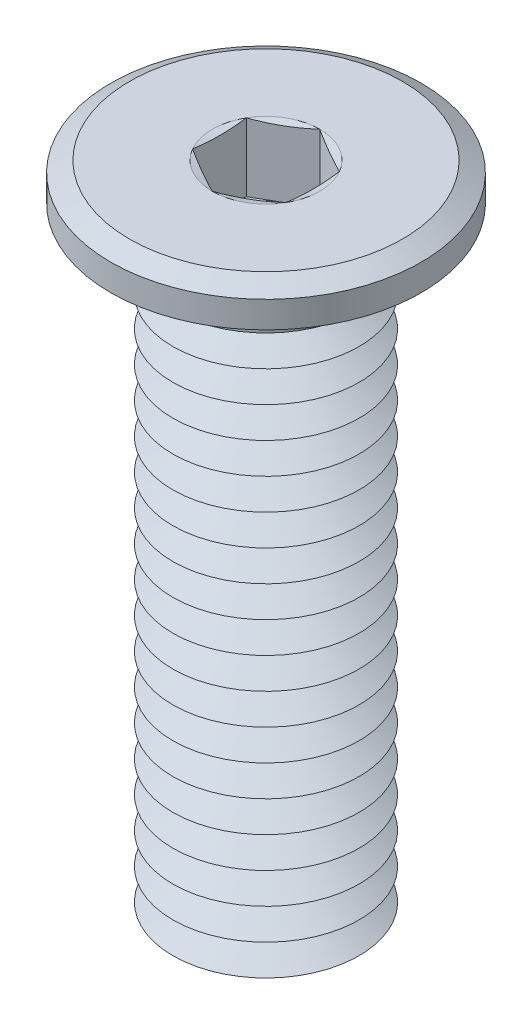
SolidWorks part; units mm, degrees
ref_plane "Front Plane" through (0, 0, 0) normal (0, 0, 1) x (1, 0, 0)
ref_plane "Top Plane" through (0, 0, 0) normal (0, 1, 0) x (1, 0, 0)
ref_plane "Right Plane" through (0, 0, 0) normal (1, 0, 0) x (0, 0, -1)
sketch "Sketch1" plane through (0, 0, 0) normal (0, 1, 0) x (1, 0, 0)
  circle A0 centre (0, 0) radius 5
  dimension "D1" = 10
extrude "Boss-Extrude1" add sketch "Sketch1" against normal blind 1.2
sketch "Sketch2" plane through (0, -1.2, 0) normal (0, -1, 0) x (1, 0, 0)
  circle A0 centre (0, 0) radius 3
  dimension "D1" = 6
extrude "Boss-Extrude2" add sketch "Sketch2" along normal blind 20
sketch "Sketch3" plane through (0, 0, 0) normal (1, 0, 0) x (0, 0, -1)
  line L0 (0, 0.9906) -> (0, -8.2999) construction
sketch "Sketch5" plane through (0, 0, 0) normal (1, 0, 0) x (0, 0, -1)
  line L0 (-3, -21.7) -> (-2.134, -21.2)
  line L1 (-3, -1.2) -> (-3, -21.2) construction
  line L2 (-2.134, -21.2) -> (-3, -20.7)
  line L3 (-3, -1.2) -> (-3, -21.2) construction
  line L4 (-3, -20.7) -> (-3, -21.7)
  line L6 (-3, -1.2) -> (-3, -21.2) construction
  line L7 (-3, -1.2) -> (-3, -21.2) construction
  line L14 (-3, -21.2) -> (3, -21.2) construction
  dimension "D1" = 1
revolve "Cut-Revolve1" cut sketch "Sketch5" angle 360 about L0
pattern_linear "LPattern1" count 19 spacing 1 along (0, 1, 0) of "Cut-Revolve1"
fillet "Fillet1" radius 0.25 1 edges at (0, -1.2, -3)
chamfer "Chamfer2" distance 0.6 angle 30 1 edges at (0, 0, 5)
sketch "Sketch6" plane through (0, 0, 0) normal (0, 1, 0) x (1, 0, 0)
  line L1 (0, 1.7321) -> (-1.5, 0.866)
  line L2 (-1.5, 0.866) -> (-1.5, -0.866)
  line L3 (-1.5, -0.866) -> (0, -1.7321)
  line L4 (0, -1.7321) -> (1.5, -0.866)
  line L5 (1.5, -0.866) -> (1.5, 0.866)
  line L6 (1.5, 0.866) -> (0, 1.7321)
  circle A0 centre (0, 0) radius 1.5 construction
  dimension "D1" = 3
extrude "Cut-Extrude1" cut sketch "Sketch6" against normal blind 2.2
sketch "Sketch7" plane through (0, -2.2, 0) normal (0, 1, 0) x (1, 0, 0)
  line L0 (-1.5, 0.866) -> (-1.5, -0.866) construction
  circle A0 centre (0, 0) radius 1.5
extrude "Cut-Extrude2" cut sketch "Sketch7" against normal through all draft 60
sketch "Sketch8" plane through (0, 0, 0) normal (0, 1, 0) x (1, 0, 0)
  circle A0 centre (0, 0) radius 1.7321
extrude "Cut-Extrude3" cut sketch "Sketch8" against normal through all draft 75
